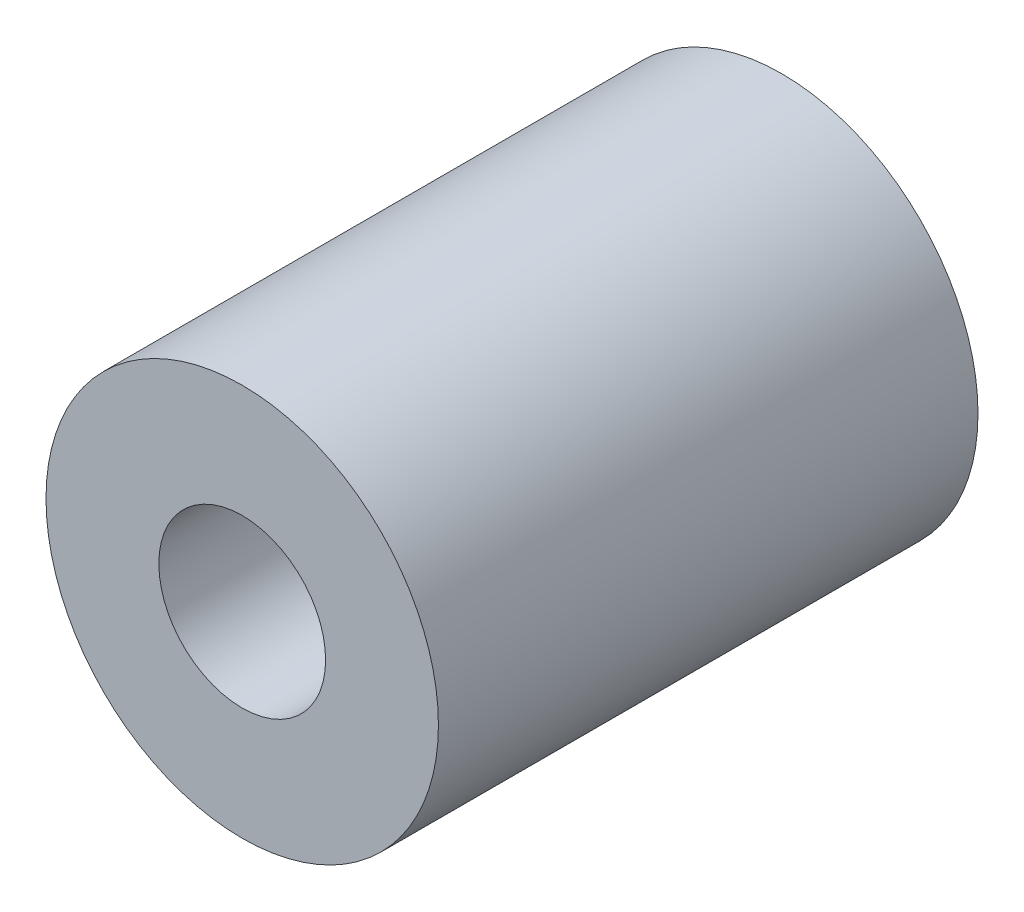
SolidWorks part; units mm, degrees
ref_plane "Plan de face" through (0, 0, 0) normal (0, 0, 1) x (1, 0, 0)
ref_plane "Plan de dessus" through (0, 0, 0) normal (0, 1, 0) x (1, 0, 0)
ref_plane "Plan de droite" through (0, 0, 0) normal (1, 0, 0) x (0, 0, -1)
sketch "Esquisse1" plane through (0, 0, 0) normal (0, 0, 1) x (1, 0, 0)
  circle A0 centre (0, 0) radius 4.25
  circle A1 centre (0, 0) radius 10
  dimension "D1" = 20
  dimension "D2" = 8.5
extrude "Extrusion1" add sketch "Esquisse1" along normal mid plane 27.5
